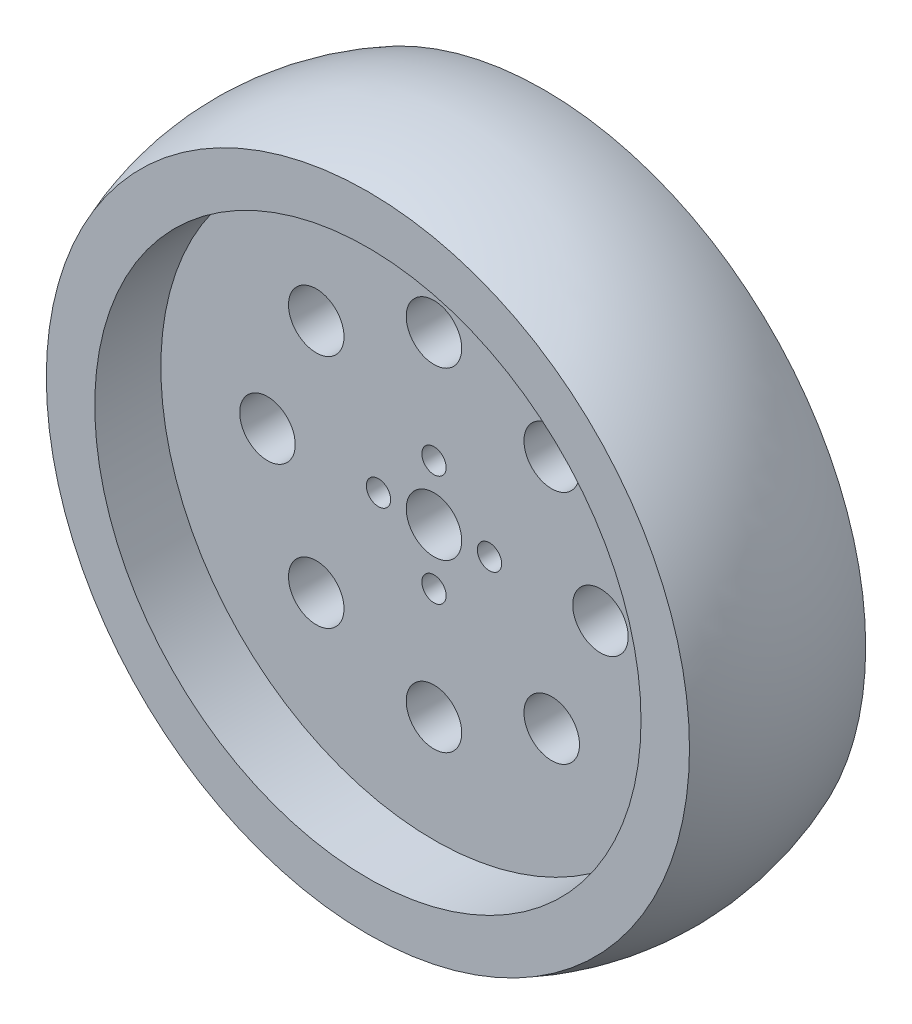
SolidWorks part; units mm, degrees
ref_plane "Front Plane" through (0, 0, 0) normal (0, 0, 1) x (1, 0, 0)
ref_plane "Top Plane" through (0, 0, 0) normal (0, 1, 0) x (1, 0, 0)
ref_plane "Right Plane" through (0, 0, 0) normal (1, 0, 0) x (0, 0, -1)
sketch "Sketch1" plane through (0, 0, 0) normal (0, 0, 1) x (1, 0, 0)
  circle A0 centre (0, 0) radius 44.45
  dimension "D1" = 88.9
extrude "Extrude1" add sketch "Sketch1" against normal blind 21.082
sketch "Sketch2" plane through (0, 0, 0) normal (0, 0, 1) x (1, 0, 0)
  circle A0 centre (0, 0) radius 39.37
  dimension "D1" = 78.74
extrude "Cut-Extrude1" cut sketch "Sketch2" against normal blind 7.366
sketch "Sketch3" plane through (0, 0, -21.082) normal (0, 0, -1) x (-1, 0, 0)
  circle A0 centre (0, 0) radius 39.37
  dimension "D1" = 78.74
extrude "Cut-Extrude2" cut sketch "Sketch3" against normal blind 7.366
sketch "Sketch4" plane through (0, 0, 0) normal (0, 0, 1) x (1, 0, 0)
  circle A0 centre (0, 0) radius 46.355
  dimension "D1" = 92.71
extrude "Extrude2" add sketch "Sketch4" along normal blind 2.159
sketch "Sketch5" plane through (0, 0, -21.082) normal (0, 0, -1) x (-1, 0, 0)
  circle A0 centre (0, 0) radius 46.355
  dimension "D1" = 92.71
extrude "Extrude3" add sketch "Sketch5" along normal blind 2.159
sketch "Sketch6" plane through (0, 0, 2.159) normal (0, 0, 1) x (1, 0, 0)
  circle A0 centre (0, 0) radius 39.37
  dimension "D1" = 78.74
extrude "Cut-Extrude3" cut sketch "Sketch6" against normal up to next
sketch "Sketch7" plane through (0, 0, -23.241) normal (0, 0, -1) x (-1, 0, 0)
  circle A0 centre (0, 0) radius 39.37
  dimension "D1" = 78.74
extrude "Cut-Extrude4" cut sketch "Sketch7" against normal up to next
sketch3d "3DSketch1"
  line L0 (0, 46.355, 2.159) -> (0, 46.355, 0)
  line L1 (0, 46.355, 0) -> (0, 44.4548, 0)
  line L2 (0, 44.4548, 0) -> (0, 44.45, -21.082)
  line L3 (0, 44.45, -21.082) -> (0, 46.355, -21.082)
  line L4 (0, 46.355, -21.082) -> (0, 46.355, -23.241)
  arc A0 (0, 46.355, 2.159) -> (0, 46.355, -23.241) centre (0, 14.5789, -10.541) cw
  circle A1 centre (0, 0, 2.159) radius 46.355 construction
  circle A2 centre (0, 0, -23.241) radius 46.355 construction
  circle A3 centre (0, 0, 0) radius 46.355 construction
  circle A4 centre (0, 0, -21.082) radius 44.45 construction
  circle A5 centre (0, 0, -21.082) radius 46.355 construction
  point P2 (-34.22, 14.5789, -10.541)
  point P7 (0, 0, 48.514)
  point P10 (0, 0, -69.596)
  point P13 (0, 0, 46.355)
  point P18 (0, 0, 23.368)
  point P22 (0, 0, -67.437)
sweep "Sweep1" add profiles "3DSketch1"
sketch "Sketch8" plane through (0, 0, -7.366) normal (0, 0, 1) x (1, 0, 0)
  circle A0 centre (0, 0) radius 4
  circle A1 centre (0, 8) radius 1.75
  circle A2 centre (8, 0) radius 1.75
  circle A3 centre (0, -8) radius 1.75
  circle A4 centre (-8, 0) radius 1.75
  dimension "D1" = 3.5
  dimension "D2" = 3.5
  dimension "D3" = 3.5
  dimension "D4" = 3.5
  dimension "D5" = 8
  dimension "D6" = 8
  dimension "D7" = 8
  dimension "D8" = 8
  dimension "D9" = 8
extrude "Cut-Extrude5" cut sketch "Sketch8" against normal through all
sketch "Sketch9" plane through (0, 0, -7.366) normal (0, 0, 1) x (1, 0, 0)
  line L0 (0, 0) -> (43.6024, 43.6024) construction
  line L1 (0, 0) -> (-40.8772, -40.8772) construction
  line L2 (0, 0) -> (39.4677, -39.4677) construction
  line L3 (0, 0) -> (-45.1999, 45.1999) construction
  circle A0 centre (0, 24) radius 4
  circle A1 centre (24, 0) radius 4
  circle A2 centre (0, -24) radius 4
  circle A3 centre (-24, 0) radius 4
  circle A4 centre (16.9706, 16.9706) radius 4
  circle A5 centre (16.9706, -16.9706) radius 4
  circle A6 centre (-16.9706, -16.9706) radius 4
  circle A7 centre (-16.9706, 16.9706) radius 4
  dimension "D1" = 8
  dimension "D2" = 8
  dimension "D3" = 8
  dimension "D4" = 8
  dimension "D5" = 8
  dimension "D6" = 8
  dimension "D7" = 8
  dimension "D8" = 8
  dimension "D9" = 24
  dimension "D10" = 24
  dimension "D11" = 24
  dimension "D12" = 24
  dimension "D13" = 24
  dimension "D14" = 24
  dimension "D15" = 24
  dimension "D16" = 24
extrude "Cut-Extrude6" cut sketch "Sketch9" against normal through all
